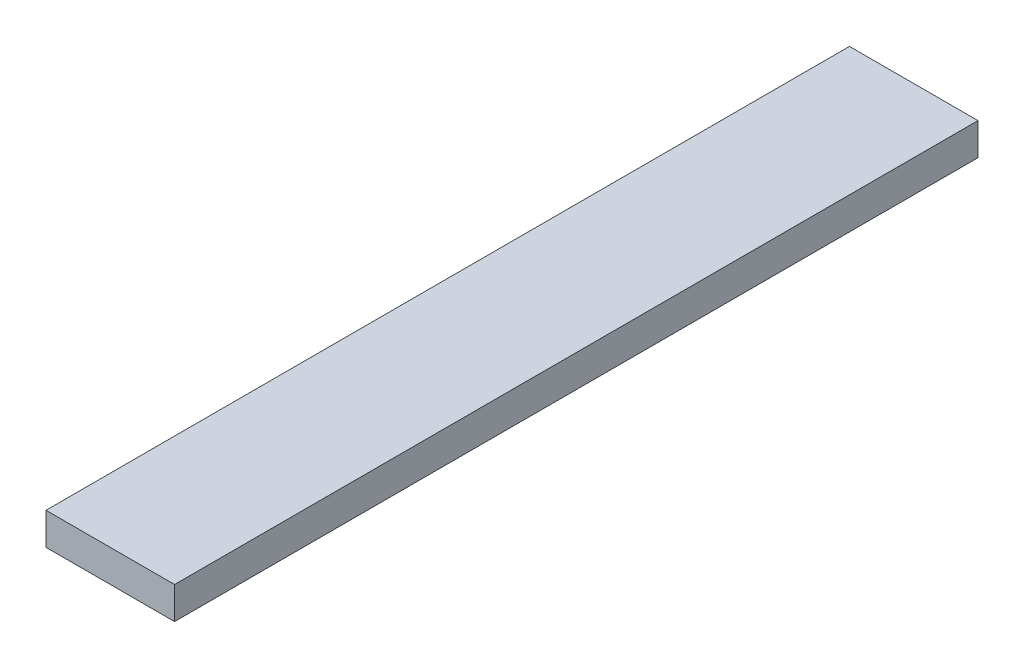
SolidWorks part; units mm, degrees
ref_plane "Face" through (0, 0, 0) normal (0, 0, 1) x (1, 0, 0)
ref_plane "Dessus" through (0, 0, 0) normal (0, 1, 0) x (1, 0, 0)
ref_plane "Droite" through (0, 0, 0) normal (1, 0, 0) x (0, 0, -1)
sketch "Esquisse1" plane through (0, 0, 0) normal (0, 0, 1) x (1, 0, 0)
  line L1 (0, 0) -> (8, 0)
  line L2 (0, 0) -> (0, 2)
  line L3 (0, 2) -> (8, 2)
  line L4 (8, 0) -> (8, 2)
  dimension "D1" = 8
  dimension "D2" = 2
extrude "Extrusion1" add sketch "Esquisse1" along normal blind 50
